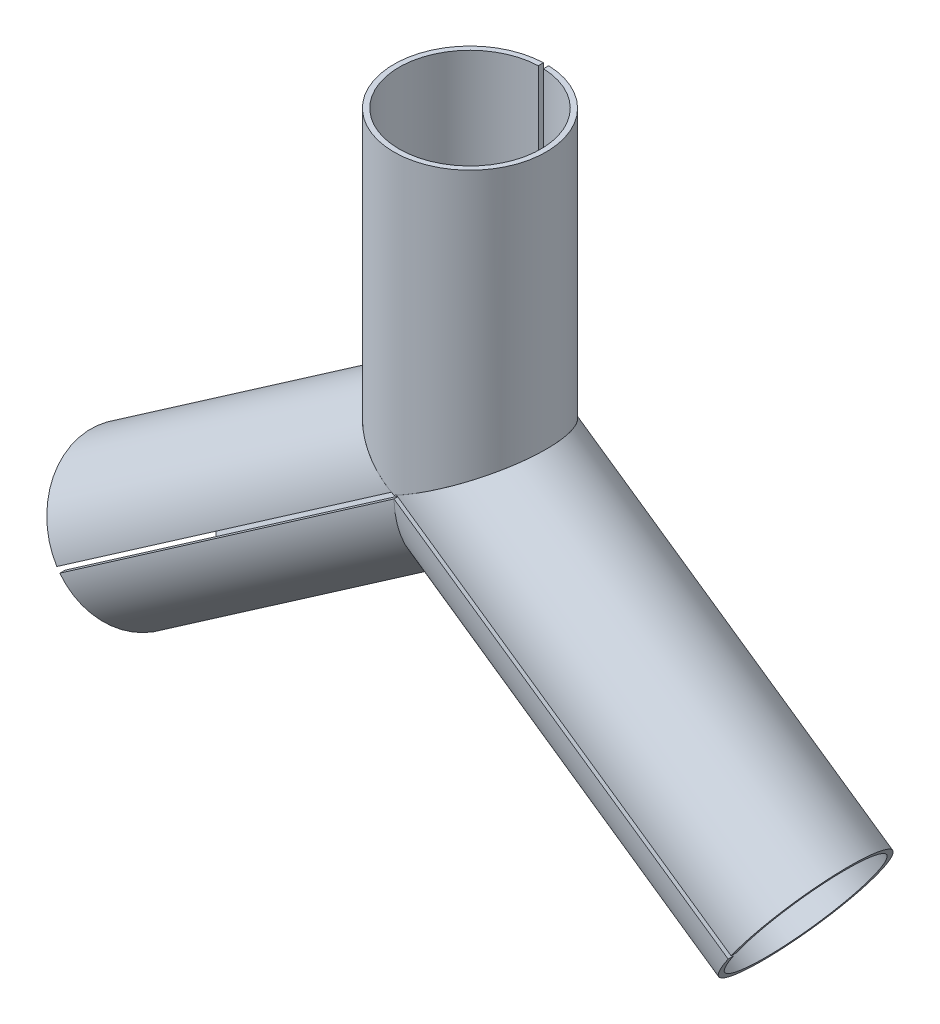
SolidWorks part; units mm, degrees
ref_plane "前视基准面" through (0, 0, 0) normal (0, 0, 1) x (1, 0, 0)
ref_plane "上视基准面" through (0, 0, 0) normal (0, 1, 0) x (1, 0, 0)
ref_plane "右视基准面" through (0, 0, 0) normal (1, 0, 0) x (0, 0, -1)
sketch "草图1" plane through (0, 0, 0) normal (0, 0, 1) x (1, 0, 0)
  line L0 (-64.7494, -44.8345) -> (0, 0) construction
  line L1 (0, 0) -> (64.7494, -44.8345) construction
  line L2 (0, 0) -> (0, 57.3433) construction
  line L3 (-14.6769, 57.3433) -> (14.6769, 57.3433) construction
  line L4 (0, 0) -> (0, -44.8345) construction
  line L5 (0, -44.8345) -> (0, -45.8345) construction
  line L6 (0, 0) -> (0, 57.3433)
  line L7 (56.3942, -56.901) -> (73.1046, -32.768) construction
  line L8 (14.6769, 57.3433) -> (14.6769, 7.6892) construction
  line L9 (14.6769, 7.6892) -> (73.1046, -32.768) construction
  line L10 (-14.6769, 57.3433) -> (-14.6769, 7.6892) construction
  line L11 (-14.6769, 7.6892) -> (0, 0) construction
  line L12 (0, 0) -> (14.6769, 7.6892) construction
  line L13 (56.3942, -56.901) -> (0, -17.8519) construction
  dimension "R" = 14.6769
  dimension "L1" = 57.3433
  dimension "L2" = 78.7567
  dimension "B" = 110.6
  dimension "t" = 1
sketch "草图2" plane through (0, 0, 0) normal (0, 1, 0) x (1, 0, 0)
  circle A0 centre (0, 0) radius 14.6769
extrude "拉伸-薄壁1" add sketch "草图2" along normal up to vertex (57.3433 mm away) thin
ref_plane "基准面1" through (64.7494, -44.8345, 0) normal (0.8221, -0.5693, 0) x (0, 0, -1)
sketch "草图3" plane through (64.7494, -44.8345, 0) normal (0.8221, -0.5693, 0) x (0, 0, -1)
  circle A0 centre (0, 0) radius 14.6769
extrude "拉伸-薄壁2" add sketch "草图3" against normal up to vertex (78.7567 mm away) separate body thin
sketch "草图4" plane through (0, 0, 0) normal (0, 0, 1) x (1, 0, 0)
  line L0 (-29.3538, 15.3784) -> (0, 0)
  line L1 (0, 0) -> (29.3538, 15.3784)
  line L2 (-29.3538, 15.3784) -> (-29.3538, -44.8345)
  line L3 (-29.3538, -44.8345) -> (29.3538, -44.8345)
  line L4 (29.3538, -44.8345) -> (29.3538, 15.3784)
extrude "切除-拉伸1" cut sketch "草图4" against normal through all and the other way through all
sketch "草图5" plane through (0, 0, 0) normal (0, 0, 1) x (1, 0, 0)
  line L0 (29.3538, 15.3784) -> (0, 0)
  line L1 (0, 0) -> (0, -44.8345)
  line L2 (0, -44.8345) -> (-14.6769, -44.8345)
  line L3 (-14.6769, -44.8345) -> (-14.6769, 15.3784)
  line L4 (-14.6769, 15.3784) -> (29.3538, 15.3784)
extrude "切除-拉伸2" cut sketch "草图5" against normal through all and the other way through all
sketch "草图6" plane through (64.7494, -44.8345, 0) normal (0.8221, -0.5693, 0) x (0, 0, -1)
  line L0 (0, 0) -> (-14.6769, 0)
  line L1 (0, -14.6769) -> (0, 14.6769) construction
  circle A0 centre (0, 0) radius 14.6769 construction
extrude "切除-拉伸-薄壁1" cut sketch "草图6" against normal through all thin
extrude "切除-拉伸-薄壁2" cut sketch "草图1" against normal through all thin
mirror "镜向1" about plane through (0, 0, 0) normal (1, 0, 0)
equation "\"D5@拉伸-薄壁1\" = \"t@草图1\""
equation "\"D5@拉伸-薄壁2\" = \"t@草图1\""
